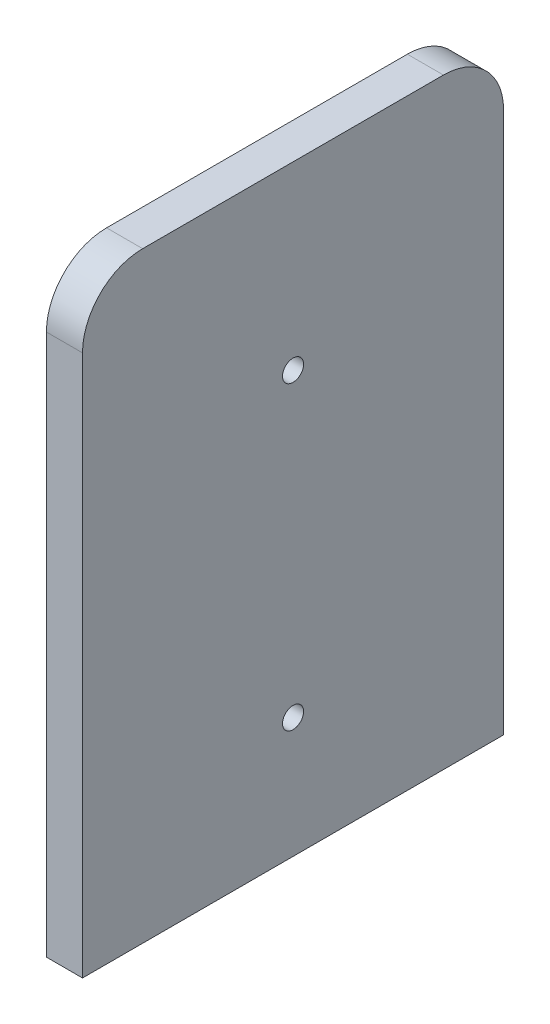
SolidWorks part; units mm, degrees
ref_plane "Front Plane" through (0, 0, 0) normal (0, 0, 1) x (1, 0, 0)
ref_plane "Top Plane" through (0, 0, 0) normal (0, 1, 0) x (1, 0, 0)
ref_plane "Right Plane" through (0, 0, 0) normal (1, 0, 0) x (0, 0, -1)
sketch "Sketch1" plane through (0, 0, 0) normal (1, 0, 0) x (0, 0, -1)
  line L1 (0, 0) -> (70, 0)
  line L2 (0, 0) -> (0, 100)
  line L3 (0, 100) -> (70, 100)
  line L4 (70, 0) -> (70, 100)
  dimension "D1" = 70
  dimension "D2" = 100
extrude "Extrude1" add sketch "Sketch1" along normal blind 6
sketch "Sketch2" plane through (0, 0, 0) normal (0, -1, 0) x (1, 0, 0)
  line L0 (3, 0) -> (3, -70) construction
  line L1 (6, 0) -> (0, 0) construction
  line L2 (6, -70) -> (0, -70) construction
  line L3 (0, -35) -> (6, -35) construction
  line L4 (0, 0) -> (0, -70) construction
  line L5 (6, 0) -> (6, -70) construction
  point P12 (3, -50)
  point P13 (3, -20)
  dimension "D1" = 15
  dimension "D2" = 15
hole_wizard "M3 Tapped Hole1" positions "3DSketch1" profile "Sketch3" tap size "M3" standard "ISO"
sketch3d "3DSketch1"
  point P0 (3, 0, -20)
  point P3 (3, 0, -50)
sketch "Sketch3" plane through (3, 0, -20) normal (1, 0, 0) x (0, 0, -1)
  line L0 (0, 0) -> (0, 10.7511)
  line L1 (0, 10.7511) -> (1.25, 10)
  line L2 (1.25, 10) -> (1.25, 6)
  line L3 (1.25, 6) -> (1.5, 6)
  line L4 (1.5, 6) -> (1.5, 0)
  line L5 (1.5, 0) -> (0, 0)
  line L10 (0, 10.7511) -> (-1.25, 10) construction
  line L11 (0, -6.35) -> (0, 107.95) construction
  dimension "Tap Drill Dia." = 2.5
  dimension "Tap Drill Depth" = 10
  dimension "Thread Major Dia." = 3
  dimension "Thread Depth" = 6
  dimension "Drill Angle" = 118
sketch "Sketch4" plane through (6, 0, 0) normal (1, 0, 0) x (0, 0, -1)
  line L0 (35, 100) -> (35, 0) construction
  line L1 (70, 100) -> (0, 100) construction
  line L2 (0, 0) -> (70, 0) construction
  circle A0 centre (35, 70) radius 1.75
  circle A1 centre (35, 20) radius 1.75
  dimension "D1" = 3.5
  dimension "D2" = 70
  dimension "D3" = 3.5
  dimension "D4" = 20
extrude "Extrude2" cut sketch "Sketch4" against normal through all
fillet "Fillet1" radius 10 2 edges at (3, 100, -70) (3, 100, 0)
